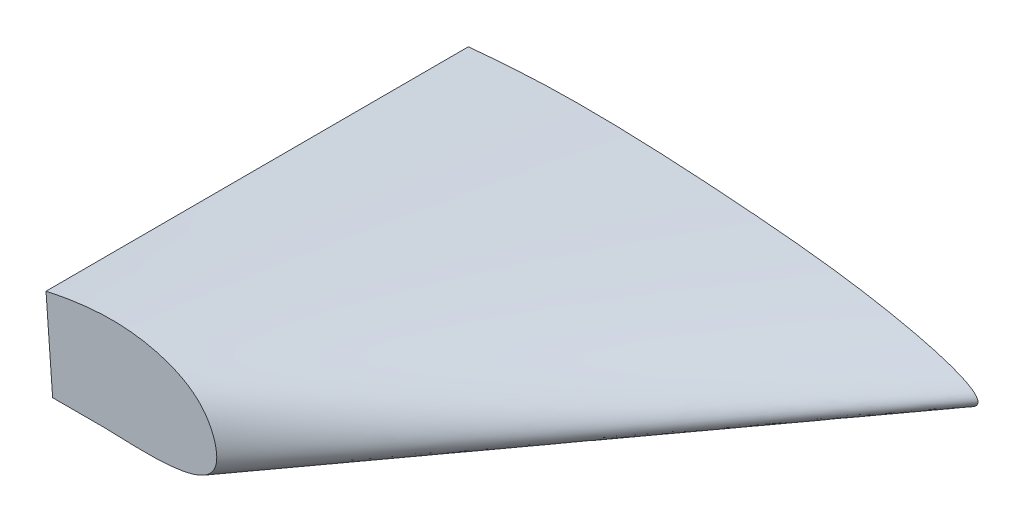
SolidWorks part; units mm, degrees
other "<Strake Left>-<Base-Loft>"
ref_plane "XY" through (0, 0, 0) normal (0, 0, 1) x (1, 0, 0)
ref_plane "XZ" through (0, 0, 0) normal (0, 1, 0) x (1, 0, 0)
ref_plane "YZ" through (0, 0, 0) normal (1, 0, 0) x (0, 0, -1)
mirrored part "Strake Left-"
